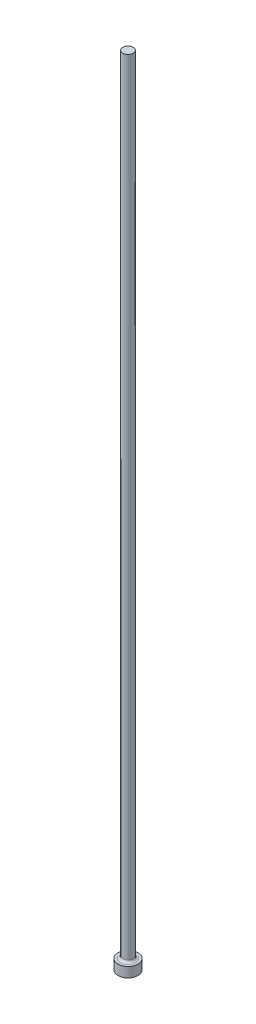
SolidWorks part; units mm, degrees
ref_plane "Front Plane" through (0, 0, 0) normal (0, 0, 1) x (1, 0, 0)
ref_plane "Top Plane" through (0, 0, 0) normal (0, 1, 0) x (1, 0, 0)
ref_plane "Right Plane" through (0, 0, 0) normal (1, 0, 0) x (0, 0, -1)
sketch "Sketch1" plane through (0, 0, 0) normal (0, 0, 1) x (1, 0, 0)
  line L0 (0, 0) -> (3.175, 0)
  line L1 (55, 0) -> (-55, 0) construction
  line L2 (3.175, 0) -> (3.175, 3.175)
  line L3 (3.175, 3.175) -> (2.413, 3.175)
  line L4 (1.651, 3.937) -> (1.651, 254)
  line L5 (1.651, 254) -> (0, 254)
  line L6 (0, 254) -> (0, 0)
  arc A0 (2.413, 3.175) -> (1.651, 3.937) centre (2.413, 3.937) cw
  dimension "D5" = 0.762
  dimension "D1" = 1.651
  dimension "D2" = 3.175
  dimension "D3" = 3.175
  dimension "D4" = 254
revolve "Revolve1" add sketch "Sketch1" angle 360 about L6
